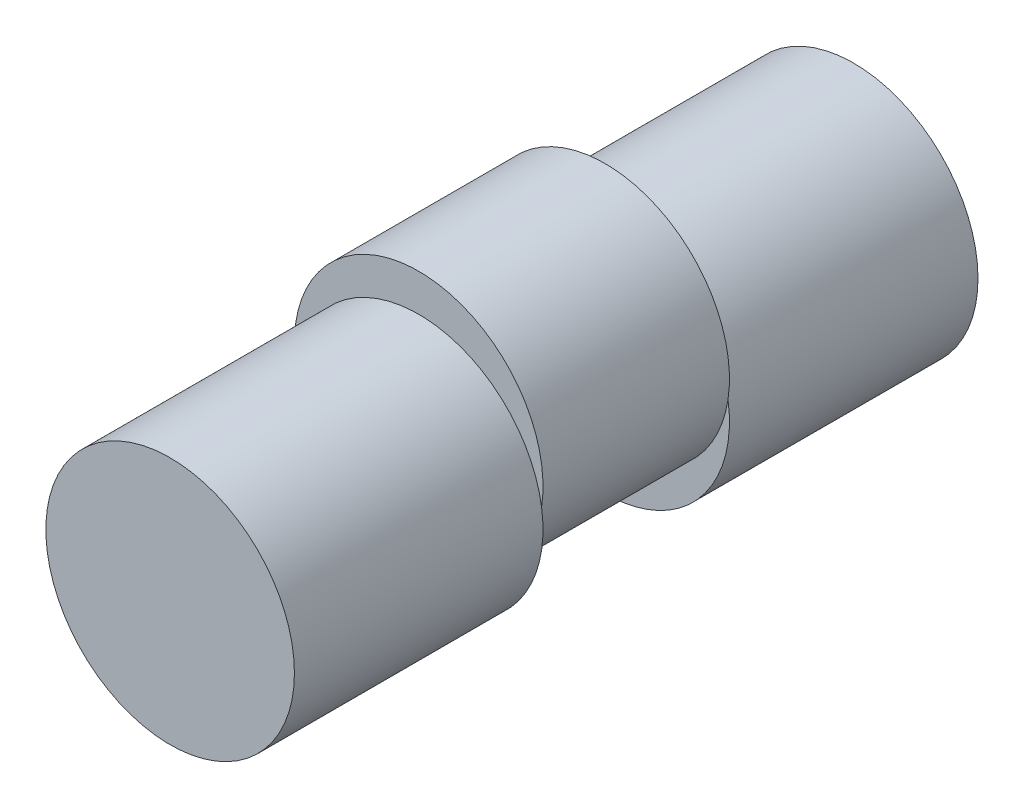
SolidWorks part; units mm, degrees
ref_plane "Plan de face" through (0, 0, 0) normal (0, 0, 1) x (1, 0, 0)
ref_plane "Plan de dessus" through (0, 0, 0) normal (0, 1, 0) x (1, 0, 0)
ref_plane "Plan de droite" through (0, 0, 0) normal (1, 0, 0) x (0, 0, -1)
sketch "Esquisse1" plane through (0, 0, 0) normal (0, 0, 1) x (1, 0, 0)
  circle A0 centre (0, 0) radius 10
extrude "Boss.-Extru.1" add sketch "Esquisse1" along normal blind 20
sketch "Esquisse2" plane through (0, 0, 20) normal (0, 0, 1) x (1, 0, 0)
  circle A0 centre (0, 3) radius 10
  dimension "D1" = 3
extrude "Boss.-Extru.2" add sketch "Esquisse2" along normal blind 15
sketch "Esquisse3" plane through (0, 0, 35) normal (0, 0, 1) x (1, 0, 0)
  circle A0 centre (0, 0) radius 10
extrude "Boss.-Extru.3" add sketch "Esquisse3" along normal blind 20
